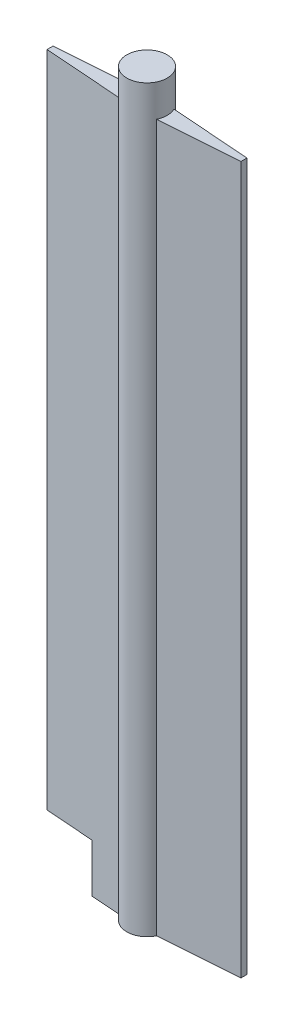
SolidWorks part; units mm, degrees
ref_plane "Front Plane" through (0, 0, 0) normal (0, 0, 1) x (1, 0, 0)
ref_plane "Top Plane" through (0, 0, 0) normal (0, 1, 0) x (1, 0, 0)
ref_plane "Right Plane" through (0, 0, 0) normal (1, 0, 0) x (0, 0, -1)
sketch "Sketch1" plane through (0, 0, 0) normal (0, 1, 0) x (1, 0, 0)
  line L0 (0, 3.175) -> (0, -3.175)
  line L3 (0, 3.175) -> (30.48, 0.9525)
  line L4 (30.48, 0.9525) -> (30.48, -0.9525)
  line L5 (30.48, -0.9525) -> (0, -3.175)
  line L6 (-30.48, -0.9525) -> (0, -3.175)
  line L7 (-30.48, 0.9525) -> (-30.48, -0.9525)
  line L8 (0, 3.175) -> (-30.48, 0.9525)
  circle A0 centre (0, 0) radius 6.35
  point P5 (30.48, 0)
  point P6 (0, 0)
  dimension "D1" = 12.7
  dimension "D2" = 6.35
  dimension "D3" = 1.905
  dimension "D4" = 30.48
extrude "Boss-Extrude1" add sketch "Sketch1" along normal blind 222.25 contours A0 L5 L4 L3 | A0 L8 L7 L6
sketch "Sketch2" plane through (0, 222.25, 0) normal (0, 1, 0) x (1, 0, 0)
  circle A0 centre (0, 0) radius 6.35
extrude "Boss-Extrude2" add sketch "Sketch2" along normal blind 10.16
sketch "Sketch3" plane through (0, 0, 0) normal (0, 0, 1) x (1, 0, 0)
  line L1 (-30.48, 0) -> (-15.24, 0)
  line L2 (-30.48, 0) -> (-30.48, 15.24)
  line L3 (-30.48, 15.24) -> (-15.24, 15.24)
  line L4 (-15.24, 0) -> (-15.24, 15.24)
  dimension "D1" = 15.24
  dimension "D2" = 15.24
extrude "Cut-Extrude1" cut sketch "Sketch3" against normal through all both and the other way through all
ref_plane "Plane1" through (0, 226.06, 0) normal (0, 1, 0) x (1, 0, 0)
sketch "Sketch4" plane through (0, 226.06, 0) normal (0, 1, 0) x (1, 0, 0)
  line L0 (5.3882, 5.3882) -> (-20.0118, 30.7882)
  line L2 (-30.7882, 20.0118) -> (-5.3882, -5.3882)
  arc A1 (-5.3882, -5.3882) -> (5.3882, 5.3882) centre (0, 0) ccw
  arc A2 (-20.0118, 30.7882) -> (-30.7882, 20.0118) centre (-25.4, 25.4) ccw
  circle A4 centre (0, 0) radius 6.35 construction
  circle A5 centre (0, 0) radius 6.35
  circle A6 centre (-25.4, 25.4) radius 1.5875
  dimension "D2" = 7.62
  dimension "D6" = 3.175
  dimension "D3" = 15.24
  dimension "D4" = 25.4
  dimension "D5" = 25.4
extrude "Boss-Extrude3" [suppressed] add sketch "Sketch4" along normal blind 3.175
